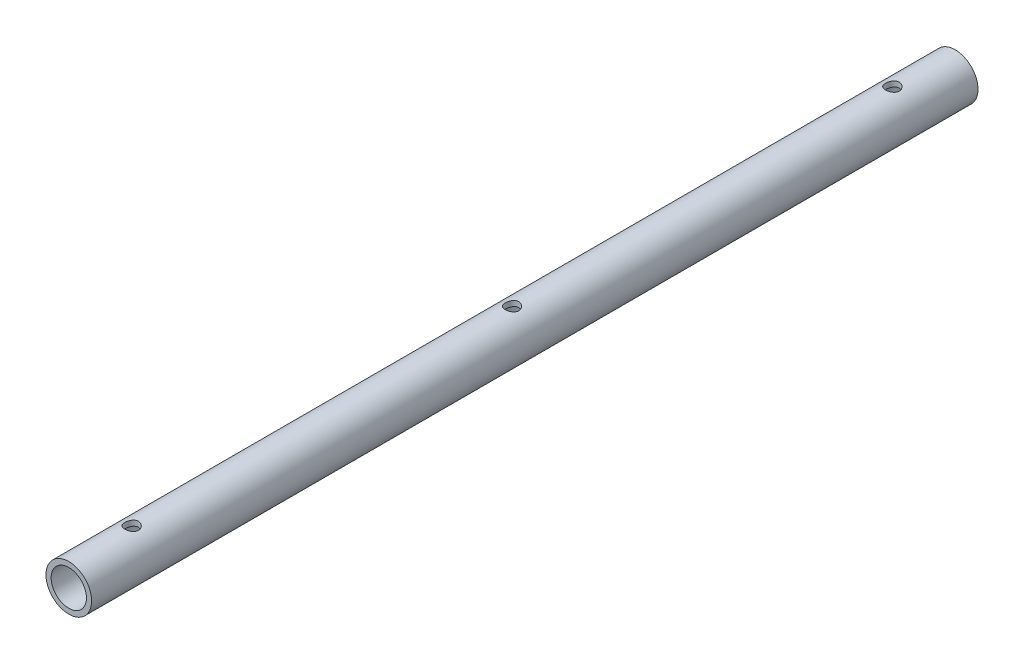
SolidWorks part; units mm, degrees
ref_plane "Front Plane" through (0, 0, 0) normal (0, 0, 1) x (1, 0, 0)
ref_plane "Top Plane" through (0, 0, 0) normal (0, 1, 0) x (1, 0, 0)
ref_plane "Right Plane" through (0, 0, 0) normal (1, 0, 0) x (0, 0, -1)
sketch "Sketch1" plane through (0, 0, 0) normal (0, 0, 1) x (1, 0, 0)
  circle A0 centre (0, 0) radius 8.255
  circle A1 centre (0, 0) radius 10.668
  dimension "D1" = 21.336
  dimension "D2" = 16.51
extrude "Extrude1" add sketch "Sketch1" along normal mid plane 414.3248
ref_plane "Plane1" through (0, 10.668, 0) normal (0, 1, 0) x (-1, 0, 0)
sketch "Sketch2" plane through (0, 10.668, 0) normal (0, 1, 0) x (-1, 0, 0)
  circle A0 centre (0, 0) radius 3.2004
  dimension "D1" = 6.4008
extrude "Cut-Extrude1" cut sketch "Sketch2" against normal through all
pattern_linear "LPattern1" count 2 spacing 177.8 along (0, 0, 1) of "Cut-Extrude1"
pattern_linear "LPattern2" count 2 spacing 177.8 along (0, 0, -1) of "Cut-Extrude1"
